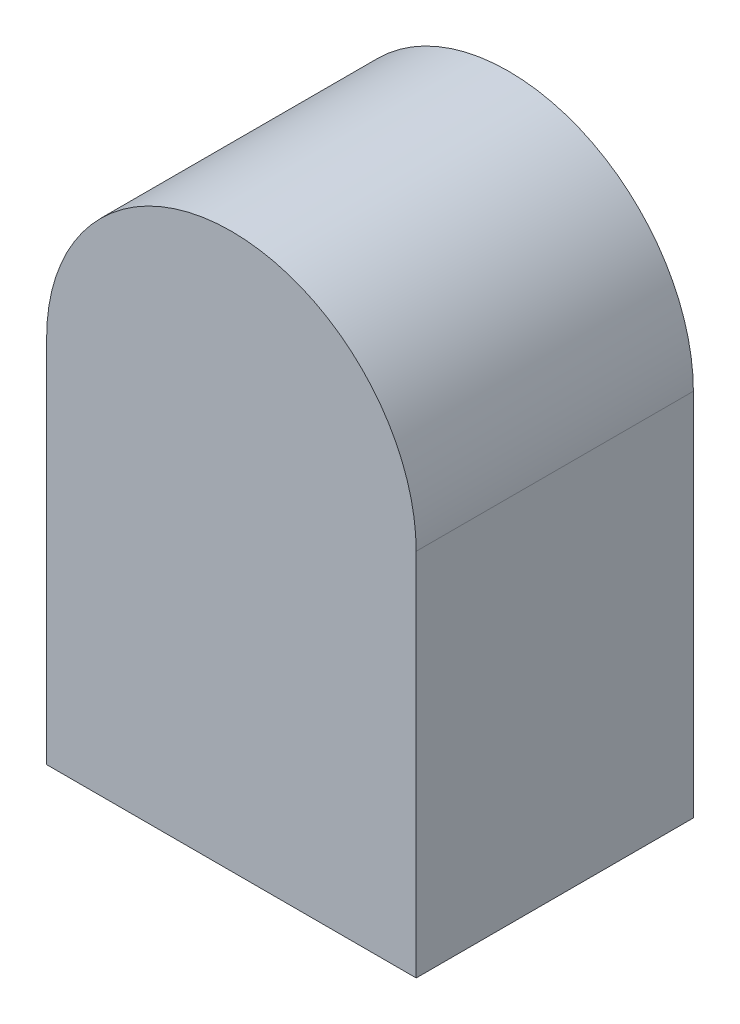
SolidWorks part; units mm, degrees
ref_plane "Front Plane" through (0, 0, 0) normal (0, 0, 1) x (1, 0, 0)
ref_plane "Top Plane" through (0, 0, 0) normal (0, 1, 0) x (1, 0, 0)
ref_plane "Right Plane" through (0, 0, 0) normal (1, 0, 0) x (0, 0, -1)
sketch "Sketch1" plane through (0, 0, 0) normal (0, 0, 1) x (1, 0, 0)
  line L0 (-25.4, 0) -> (-25.4, 50.8)
  line L1 (25.4, 50.8) -> (25.4, 0)
  line L2 (25.4, 0) -> (-25.4, 0)
  arc A0 (-25.4, 50.8) -> (25.4, 50.8) centre (0, 50.8) cw
  point P4 (0, 0)
  dimension "D1" = 50.8
  dimension "D2" = 50.8
extrude "Extrude1" add sketch "Sketch1" against normal blind 38.1
ref_plane "Plane1" through (0, 0, 101.6) normal (0, 0, 1) x (1, 0, 0)
